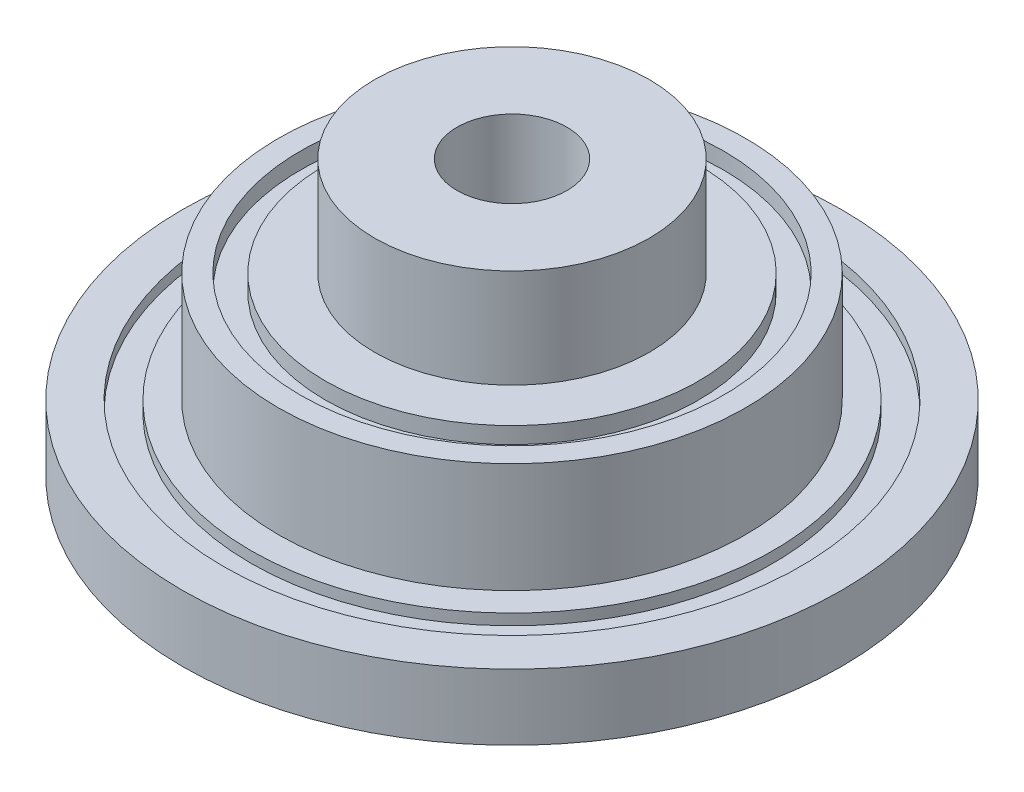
SolidWorks part; units mm, degrees
ref_plane "Front Plane" through (0, 0, 0) normal (0, 0, 1) x (1, 0, 0)
ref_plane "Top Plane" through (0, 0, 0) normal (0, 1, 0) x (1, 0, 0)
ref_plane "Right Plane" through (0, 0, 0) normal (1, 0, 0) x (0, 0, -1)
sketch "Sketch1" plane through (0, 0, 0) normal (0, 1, 0) x (1, 0, 0)
  circle A0 centre (0, 0) radius 60
  dimension "D1" = 120
extrude "Extrude1" add sketch "Sketch1" along normal blind 12
sketch "Sketch2" plane through (0, 12, 0) normal (0, 1, 0) x (-1, 0, 0)
  circle A0 centre (0, 0) radius 47.5
  circle A1 centre (0, 0) radius 52.5
  dimension "D1" = 105
  dimension "D2" = 95
extrude "Cut-Extrude1" cut sketch "Sketch2" against normal blind 2
sketch "Sketch3" plane through (0, 12, 0) normal (0, 1, 0) x (-1, 0, 0)
  circle A0 centre (0, 0) radius 42.5
  dimension "D1" = 85
extrude "Extrude2" add sketch "Sketch3" along normal blind 20
sketch "Sketch4" plane through (0, 32, 0) normal (0, 1, 0) x (-1, 0, 0)
  circle A0 centre (0, 0) radius 38.5
  circle A1 centre (0, 0) radius 34
  dimension "D1" = 77
  dimension "D2" = 68
extrude "Cut-Extrude2" cut sketch "Sketch4" against normal blind 3
sketch "Sketch5" plane through (0, 32, 0) normal (0, 1, 0) x (-1, 0, 0)
  circle A0 centre (0, 0) radius 25
  dimension "D1" = 50
extrude "Extrude3" add sketch "Sketch5" along normal blind 18
sketch "Sketch10" plane through (0, 50, 0) normal (0, 1, 0) x (1, 0, 0)
  circle A0 centre (0, 0) radius 10
  dimension "D1" = 20
extrude "Cut-Extrude7" cut sketch "Sketch10" against normal blind 38
